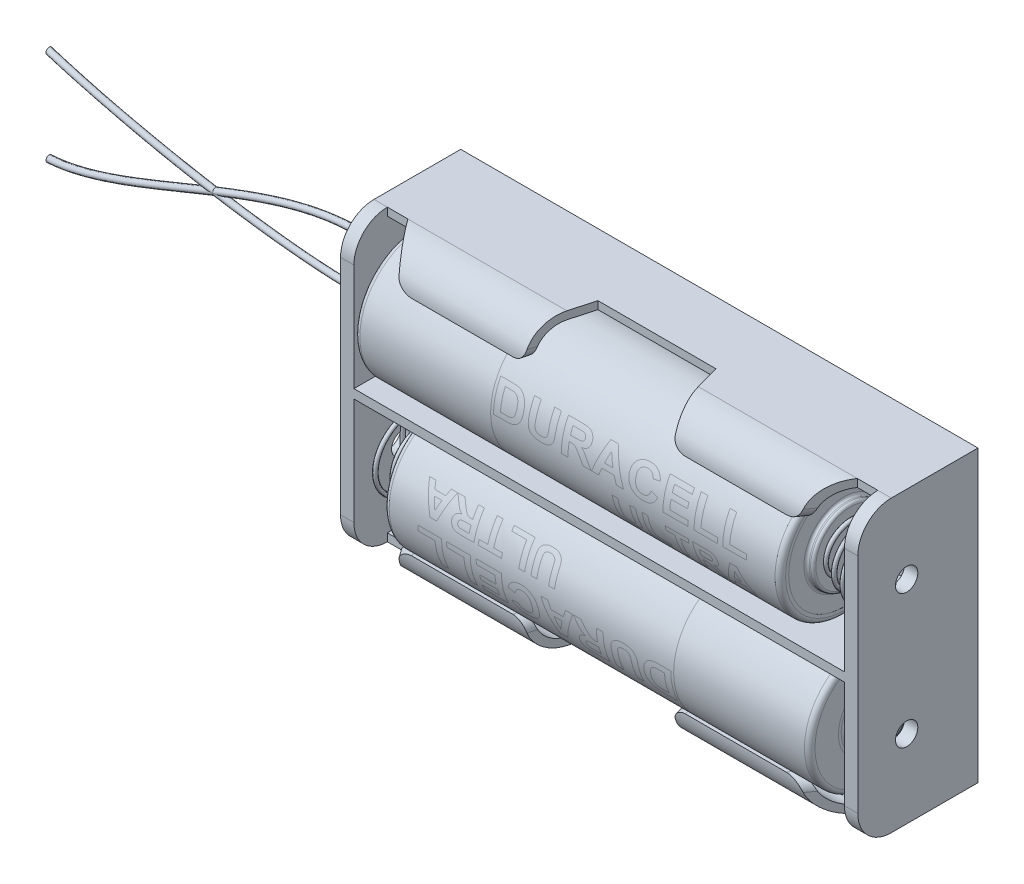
SolidWorks part; units mm, degrees
ref_plane "Front Plane" through (0, 0, 0) normal (0, 0, 1) x (1, 0, 0)
ref_plane "Top Plane" through (0, 0, 0) normal (0, 1, 0) x (1, 0, 0)
ref_plane "Right Plane" through (0, 0, 0) normal (1, 0, 0) x (0, 0, -1)
imported_body "Imported30"
imported_body "Imported31"
imported_body "Imported32"
imported_body "Imported33"
imported_body "Imported34"
imported_body "Imported35"
imported_body "Imported36"
imported_body "Surface-Imported60"
sketch "Sketch1" plane through (0, 0, 0) normal (0, 0, 1) x (1, 0, 0)
  line L1 (-91.901, 11.1398) -> (-73.8227, 11.1398)
  line L2 (-91.901, 11.1398) -> (-91.901, -10.7578)
  line L3 (-91.901, -10.7578) -> (-73.8227, -10.7578)
  line L4 (-73.8227, 11.1398) -> (-73.8227, -10.7578)
extrude "Extrude1" cut sketch "Sketch1" against normal mid plane 10
